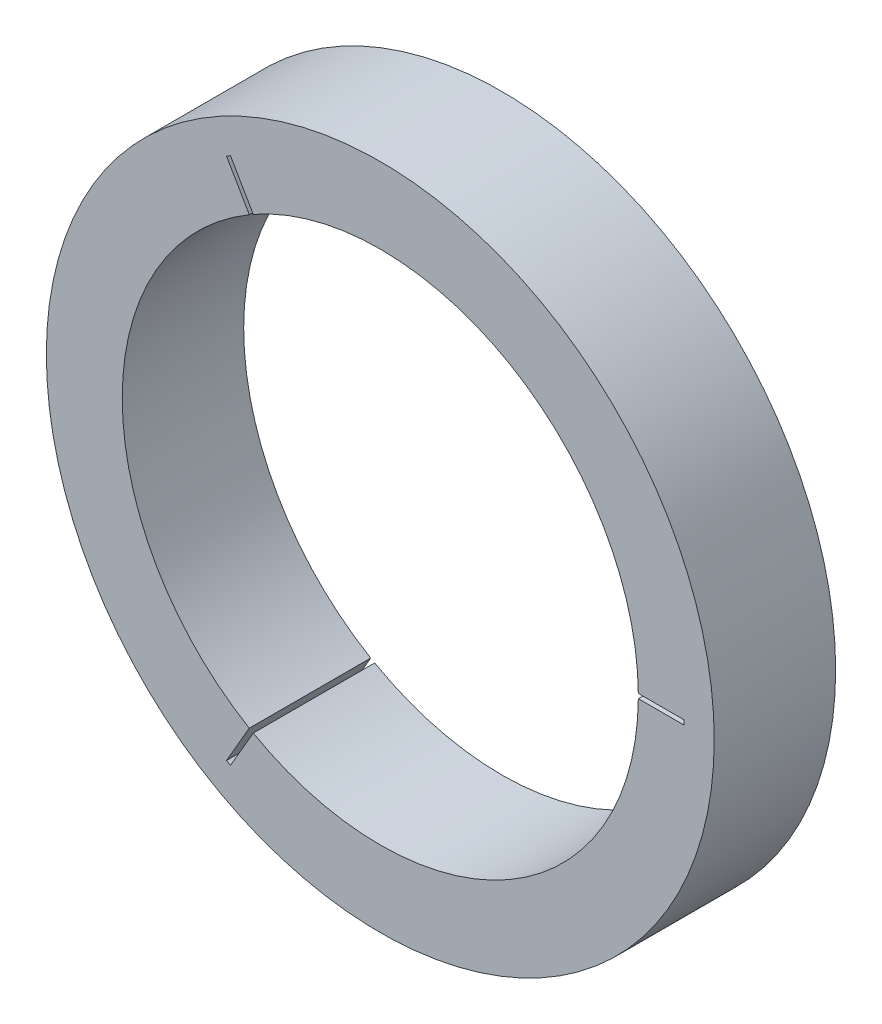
SolidWorks part; units mm, degrees
ref_plane "Front" through (0, 0, 0) normal (0, 0, 1) x (1, 0, 0)
ref_plane "Top" through (0, 0, 0) normal (0, 1, 0) x (1, 0, 0)
ref_plane "Right" through (0, 0, 0) normal (1, 0, 0) x (0, 0, -1)
sketch "Sketch1" plane through (0, 0, 0) normal (0, 0, 1) x (1, 0, 0)
  circle A0 centre (0, 0) radius 110
  dimension "D1" = 220
extrude "Extrude1" add sketch "Sketch1" along normal blind 40
sketch "Sketch2" plane through (0, 0, 40) normal (0, 0, 1) x (1, 0, 0)
  circle A0 centre (0, 0) radius 85
  dimension "D1" = 170
extrude "Cut-Extrude1" cut sketch "Sketch2" against normal through all
sketch "Sketch3" plane through (0, 0, 40) normal (0, 0, 1) x (1, 0, 0)
  line L0 (0, 0) -> (119.2174, 0) construction
  line L1 (100, -0.75) -> (100, 0.75)
  line L2 (100, 0.75) -> (80, 0.75)
  line L3 (80, -0.75) -> (80, 0.75)
  line L4 (100, -0.75) -> (80, -0.75)
  circle A0 centre (0, 0) radius 85 construction
  dimension "D1" = 170
  dimension "D4" = 100
  dimension "D5" = 20
  dimension "D2" = 1.5
  dimension "D3" = 0.75
extrude "Cut-Extrude2" cut sketch "Sketch3" against normal through all
pattern_circular "CirPattern1" count 3 over 360 about axis through (0, 0, 0) along (0, 0, 1) of "Cut-Extrude2"
equation "\"D3@Sketch3\" = \"D2@Sketch3\"/2"
